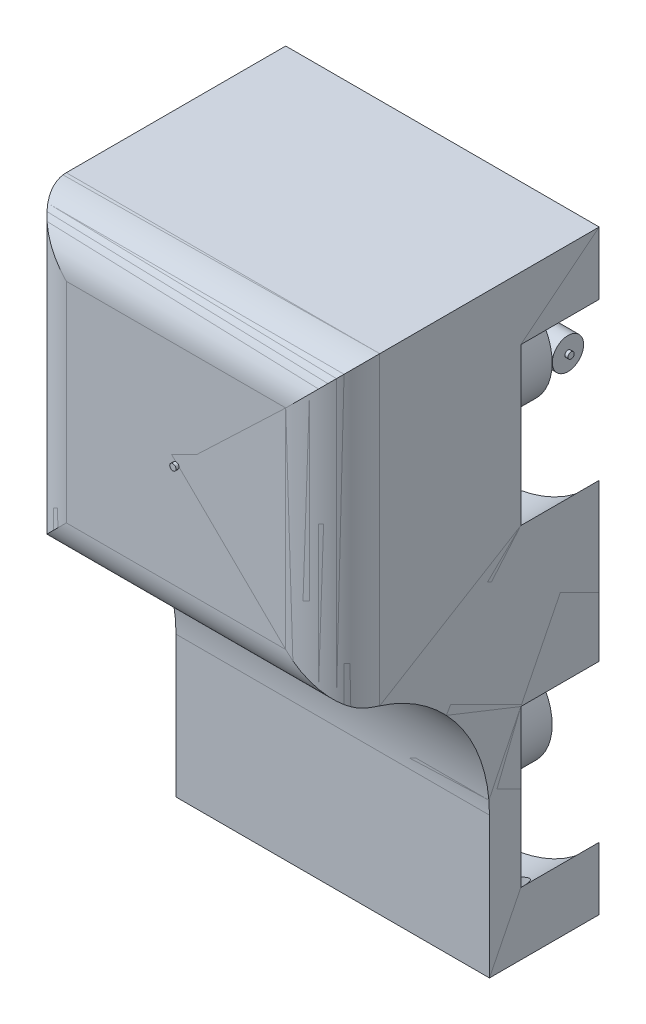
SolidWorks part; units mm, degrees
ref_plane "Front Plane" through (0, 0, 0) normal (0, 0, 1) x (1, 0, 0)
ref_plane "Top Plane" through (0, 0, 0) normal (0, 1, 0) x (1, 0, 0)
ref_plane "Right Plane" through (0, 0, 0) normal (1, 0, 0) x (0, 0, -1)
imported_body "Chassis.step<1>"
sketch "Sketch1" plane through (431.8, 0, 0) normal (1, 0, 0) x (0, 0, -1)
  line L0 (25.6386, 762) -> (25.6386, 711.2) construction
  line L1 (51.0386, 736.6) -> (0.2386, 736.6) construction
  circle A0 centre (25.6386, 736.6) radius 25.4 construction
  arc A1 (25.4, 761.9989) -> (25.4, 711.2011) centre (25.6386, 736.6) ccw construction
  circle A2 centre (25.6386, 736.6) radius 5.08
extrude "Boss-Extrude1" add sketch "Sketch1" along normal blind 5.08
sketch "Sketch2" plane through (76.2, 0, 0) normal (-1, 0, 0) x (0, 0, 1)
  line L0 (-51.0386, 736.6) -> (-0.2386, 736.6) construction
  line L1 (-25.6386, 762) -> (-25.6386, 711.2) construction
  circle A0 centre (-25.6386, 736.6) radius 25.4 construction
  circle A1 centre (-25.6386, 736.6) radius 5.08
extrude "Boss-Extrude2" add sketch "Sketch2" along normal blind 5.08
sketch "Sketch3" plane through (0, 0, 431.8) normal (0, 0, 1) x (1, 0, 0)
  line L0 (254, 889) -> (254, 549.8874) construction
  line L1 (76.2, 889) -> (431.8, 889) construction
  line L2 (431.8, 549.8874) -> (76.2, 549.8874) construction
  line L3 (76.2, 549.8874) -> (76.2, 889) construction
  line L4 (76.2, 719.4437) -> (431.8, 719.4437) construction
  line L5 (431.8, 889) -> (431.8, 549.8874) construction
  circle A0 centre (254, 719.4437) radius 5.08
extrude "Boss-Extrude3" add sketch "Sketch3" along normal blind 5.08
